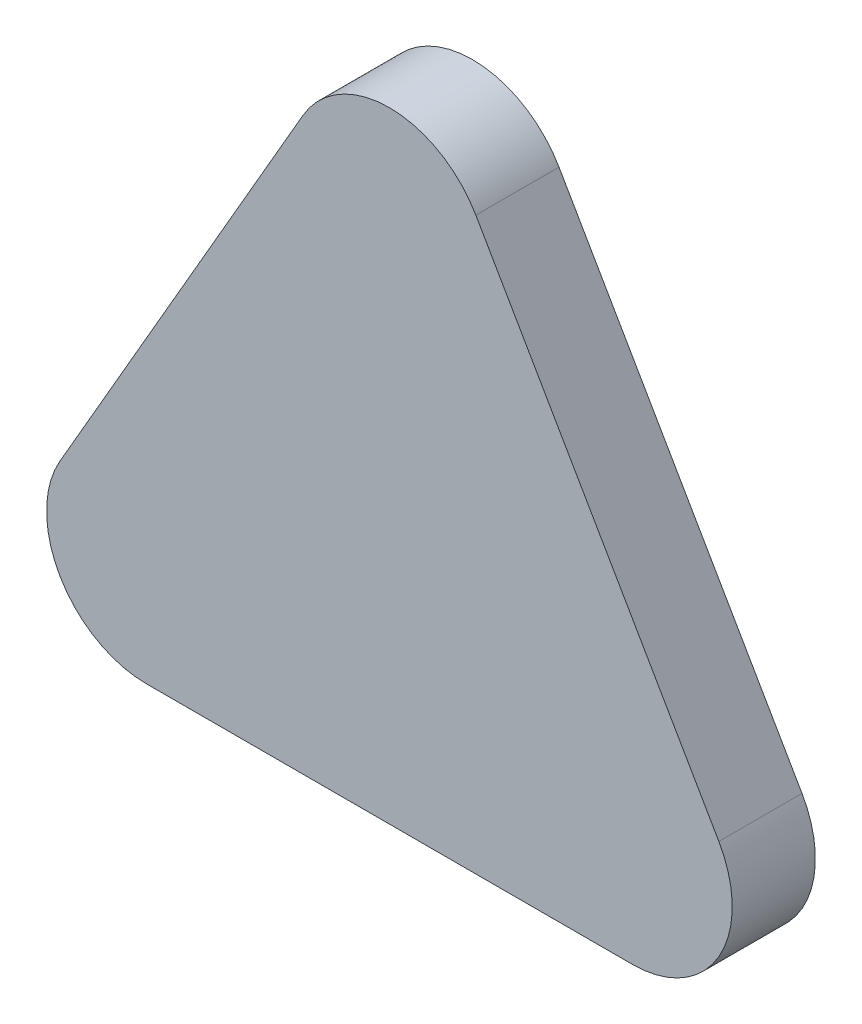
SolidWorks part; units mm, degrees
ref_plane "Front" through (0, 0, 0) normal (0, 0, 1) x (1, 0, 0)
ref_plane "Top" through (0, 0, 0) normal (0, 1, 0) x (1, 0, 0)
ref_plane "Right" through (0, 0, 0) normal (1, 0, 0) x (0, 0, -1)
sketch "Sketch1" plane through (0, 0, 0) normal (0, 0, 1) x (1, 0, 0)
  line L0 (-18.5518, 0) -> (18.5518, 0)
  line L1 (25.1509, 11.43) -> (6.5991, 43.5626)
  line L2 (-6.5991, 43.5626) -> (-25.1509, 11.43)
  arc A0 (6.5991, 43.5626) -> (-6.5991, 43.5626) centre (0, 39.7526) ccw
  arc A1 (-18.5518, 0) -> (-25.1509, 11.43) centre (-18.5518, 7.62) cw
  arc A2 (18.5518, 0) -> (25.1509, 11.43) centre (18.5518, 7.62) ccw
  point P3 (0, 0)
  point P7 (0, 54.9926)
  point P12 (31.75, 0)
  dimension "D2" = 7.62
  dimension "D1" = 63.5
extrude "Extrude1" add sketch "Sketch1" along normal blind 6.35
sketch "Sketch2" plane through (0, 0, 6.35) normal (0, 0, 1) x (1, 0, 0)
  circle A0 centre (0, 39.7526) radius 3.175
  circle A1 centre (18.5518, 7.62) radius 3.175
  circle A2 centre (-18.5518, 7.62) radius 3.175
  dimension "D1" = 6.35
